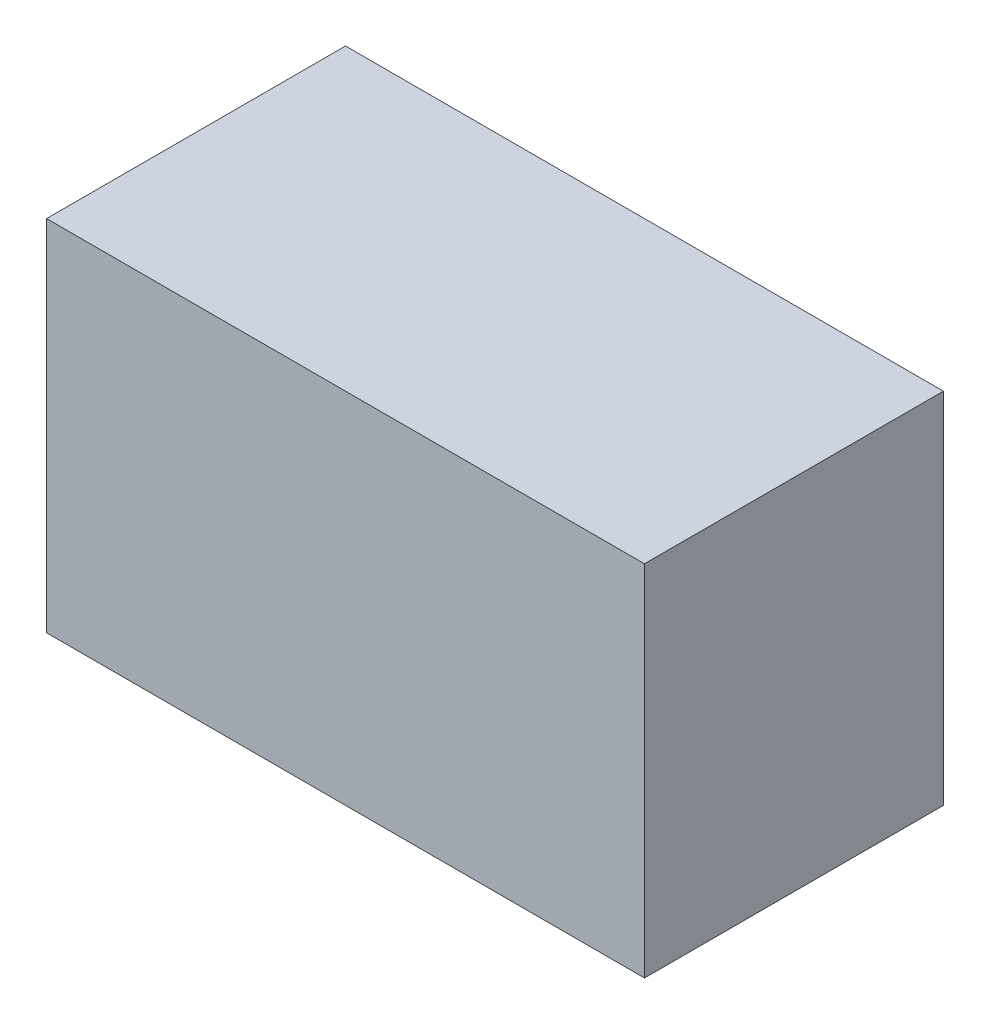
SolidWorks part; units mm, degrees
ref_plane "Face" through (0, 0, 0) normal (0, 0, 1) x (1, 0, 0)
ref_plane "Dessus" through (0, 0, 0) normal (0, 1, 0) x (1, 0, 0)
ref_plane "Droite" through (0, 0, 0) normal (1, 0, 0) x (0, 0, -1)
sketch "Esquisse1" plane through (0, 0, 0) normal (0, 0, 1) x (1, 0, 0)
  line L1 (-15, 9) -> (15, 9)
  line L2 (-15, 9) -> (-15, -9)
  line L3 (-15, -9) -> (15, -9)
  line L4 (15, 9) -> (15, -9)
  dimension "D1" = 30
  dimension "D2" = 18
  dimension "D3" = 9
  dimension "D4" = 15
extrude "Base-Extrusion" add sketch "Esquisse1" along normal blind 15
